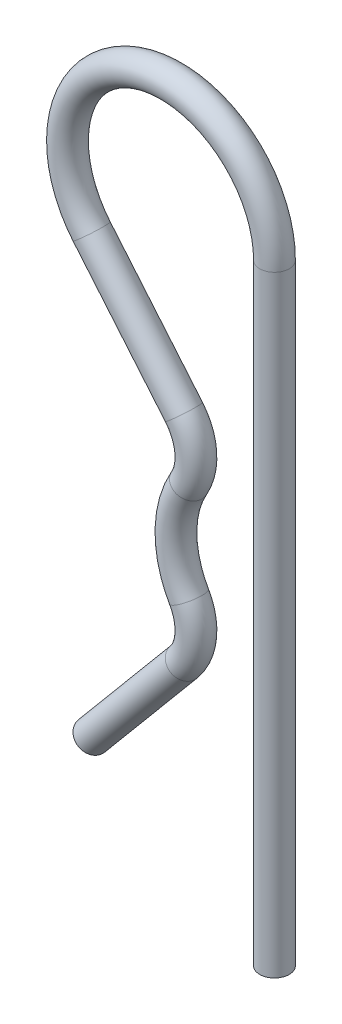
SolidWorks part; units mm, degrees
ref_plane "Plan1" through (0, 0, 0) normal (0, 0, 1) x (1, 0, 0)
ref_plane "Plan2" through (0, 0, 0) normal (0, 1, 0) x (1, 0, 0)
ref_plane "Plan3" through (0, 0, 0) normal (1, 0, 0) x (0, 0, -1)
sketch "Esquisse1" plane through (0, 0, 0) normal (0, 0, 1) x (1, 0, 0)
  line L0 (0, 0) -> (0, 20.625) construction
  line L1 (-9.2757, 11.081) -> (-4.5952, 5.4895) construction
  line L2 (0, 0) -> (-20.625, 0) construction
  line L4 (0, 14.4509) -> (0, 0) construction
  line L5 (0, 0) -> (0, -16.5491) construction
  line L6 (-5.25, 19.7009) -> (0, 19.7009) construction
  line L7 (-9.2757, -11.081) -> (-4.5952, -5.4895) construction
  circle A0 centre (0, 0) radius 20.625 construction
  arc A1 (0, 14.4509) -> (-9.2757, 11.081) centre (-5.25, 14.4509) ccw construction
  arc A2 (-4.3331, 2.4948) -> (-4.3331, -2.4948) centre (0, 0) ccw construction
  arc A3 (-4.5952, 5.4895) -> (-4.3331, 2.4948) centre (-6.608, 3.8046) cw construction
  arc A5 (-4.3331, -2.4948) -> (-4.5952, -5.4895) centre (-6.608, -3.8046) cw
  dimension "D1" = 41.25
  dimension "D2" = 10.5
  dimension "D3" = 5
  dimension "D7" = 2.625
  dimension "D4" = 2.625
  dimension "D6" = 36.25
sketch "Esquisse4" plane through (0, 0, 0) normal (0, 0, 1) x (1, 0, 0)
  line L7 (0, -16.5491) -> (0, 14.4509)
  line L8 (-9.2757, 11.081) -> (-4.5952, 5.4895) construction
  line L9 (-9.2757, 11.081) -> (-4.5952, 5.4895)
  line L10 (-9.2757, -11.081) -> (-4.5952, -5.4895) construction
  line L11 (-9.2757, -11.081) -> (-4.5952, -5.4895)
  arc A7 (0, 14.4509) -> (-9.2757, 11.081) centre (-5.25, 14.4509) ccw construction
  arc A8 (0, 14.4509) -> (-9.2757, 11.081) centre (-5.25, 14.4509) ccw
  arc A9 (-4.5952, -5.4895) -> (-4.3331, -2.4948) centre (-6.608, -3.8046) ccw construction
  arc A10 (-4.3331, 2.4948) -> (-4.3331, -2.4948) centre (0, 0) ccw construction
  arc A11 (-4.3331, 2.4948) -> (-4.5952, 5.4895) centre (-6.608, 3.8046) ccw construction
  arc A12 (-4.5952, -5.4895) -> (-4.3331, -2.4948) centre (-6.608, -3.8046) ccw
  arc A13 (-4.3331, 2.4948) -> (-4.3331, -2.4948) centre (0, 0) ccw
  arc A14 (-4.3331, 2.4948) -> (-4.5952, 5.4895) centre (-6.608, 3.8046) ccw
ref_plane "Plan5" through (0, -16.5491, 0) normal (0, 1, 0) x (-1, 0, 0)
sketch "Esquisse2" plane through (0, -16.5491, 0) normal (0, 1, 0) x (1, 0, 0)
  circle A0 centre (0, 0) radius 0.75
  dimension "D1" = 1.5
sweep "Base-Balayage" add profiles "Esquisse2" path "Esquisse4"
equation "\"D7@Esquisse1\"=\"D2@Esquisse1\"/4"
equation "\"D4@Esquisse1\"=\"D7@Esquisse1\""
